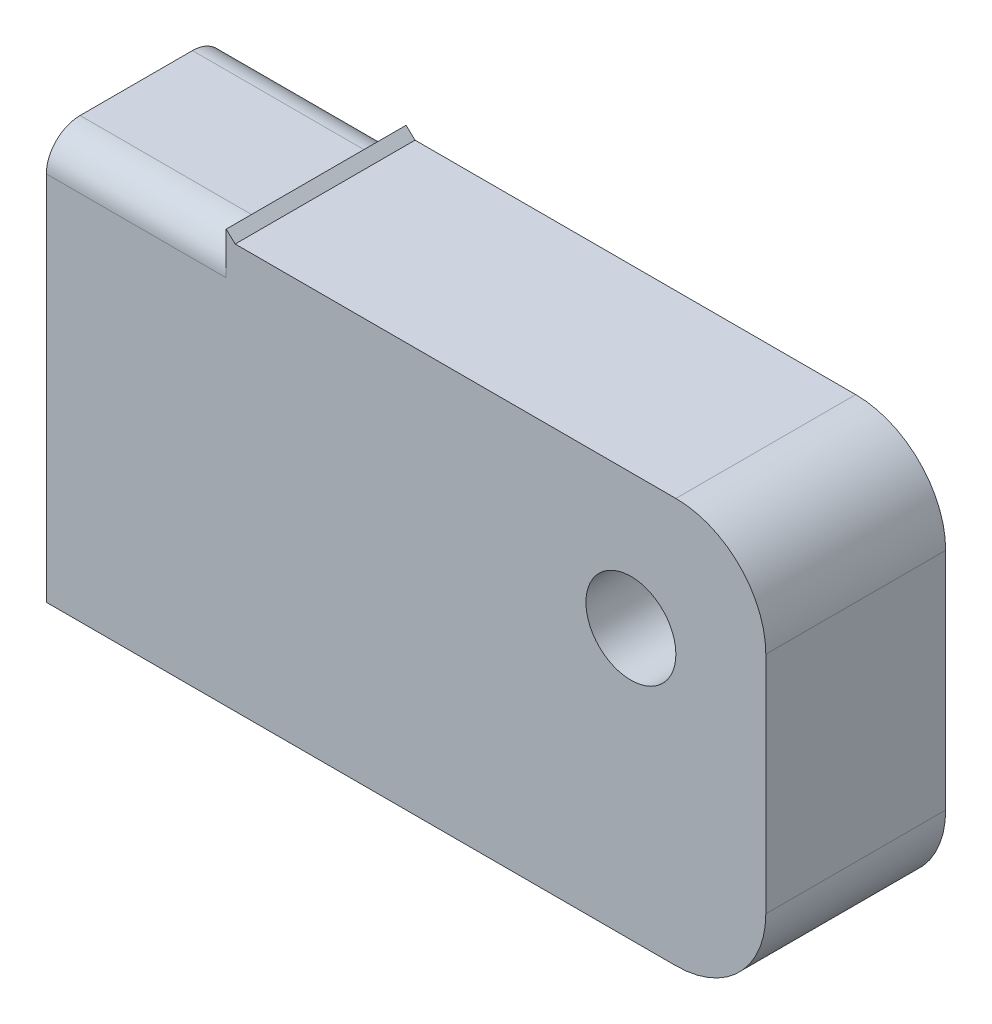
SolidWorks part; units mm, degrees
ref_plane "Front Plane" through (0, 0, 0) normal (0, 0, 1) x (1, 0, 0)
ref_plane "Top Plane" through (0, 0, 0) normal (0, 1, 0) x (1, 0, 0)
ref_plane "Right Plane" through (0, 0, 0) normal (1, 0, 0) x (0, 0, -1)
sketch "Sketch1" plane through (0, 0, 0) normal (0, 0, 1) x (1, 0, 0)
  line L0 (0, 0) -> (-203.2, 0)
  line L1 (-203.2, 0) -> (-203.2, -114.3)
  line L2 (-203.2, -114.3) -> (0, -114.3)
  line L3 (0, -114.3) -> (0, 0)
  dimension "D1" = 203.2
  dimension "D2" = 114.3
extrude "Extrude1" add sketch "Sketch1" along normal blind 50.8
sketch "Sketch2" plane through (0, 0, 50.8) normal (0, 0, 1) x (1, 0, 0)
  line L0 (0, -114.3) -> (0, 0) construction
  line L1 (0, 0) -> (-203.2, 0) construction
  circle A0 centre (-38.1, -38.1) radius 12.7
  dimension "D1" = 25.4
  dimension "D2" = 38.1
  dimension "D3" = 38.1
extrude "Cut-Extrude1" cut sketch "Sketch2" against normal through all
fillet "Fillet1" radius 25.4 2 edges at (0, 0, 25.4) (0, -114.3, 25.4)
sketch "Sketch3" plane through (0, 0, 50.8) normal (0, 0, 1) x (1, 0, 0)
  line L0 (-152.4, 0) -> (-152.4, 2.3708)
  line L1 (-25.4, 0) -> (-203.2, 0) construction
  line L2 (-152.4, 2.3708) -> (-149.86, 0)
  line L3 (-149.86, 0) -> (-152.4, 0)
  dimension "D1" = 50.8
  dimension "D2" = 53.34
extrude "Extrude2" add sketch "Sketch3" against normal through all
fillet "Fillet5" radius 9.525 2 edges at (-177.8, 0, 50.8) (-177.8, 0, 0)
